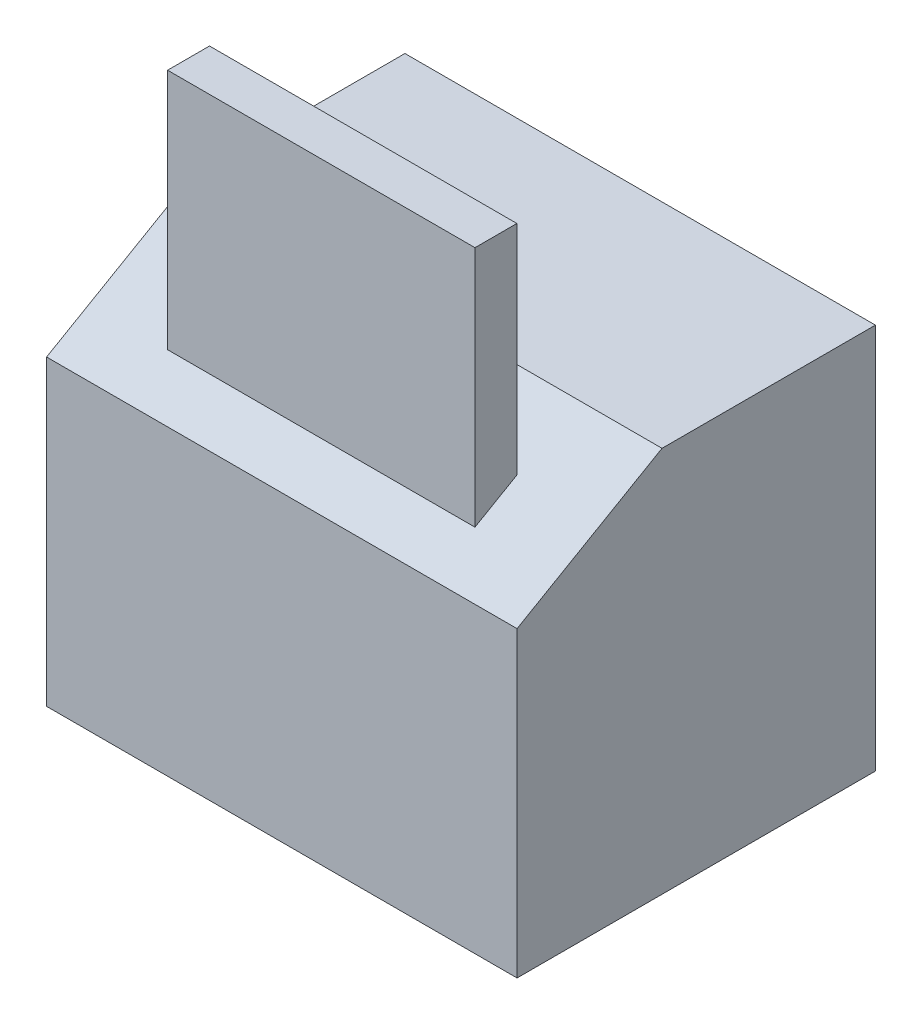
SolidWorks part; units mm, degrees
ref_plane "Front Plane" through (0, 0, 0) normal (0, 0, 1) x (1, 0, 0)
ref_plane "Top Plane" through (0, 0, 0) normal (0, 1, 0) x (1, 0, 0)
ref_plane "Right Plane" through (0, 0, 0) normal (1, 0, 0) x (0, 0, -1)
sketch "Sketch1" plane through (0, 0, 0) normal (0, 1, 0) x (1, 0, 0)
  line L1 (-45.9255, 34.384) -> (46.8873, 34.384)
  line L2 (-45.9255, 34.384) -> (-45.9255, -36.3076)
  line L3 (-45.9255, -36.3076) -> (46.8873, -36.3076)
  line L4 (46.8873, 34.384) -> (46.8873, -36.3076)
extrude "Extrude1" add sketch "Sketch1" along normal blind 76.2
sketch "Sketch2" plane through (0, 76.2, 0) normal (0, 1, 0) x (-1, 0, 0)
  line L1 (-30.2272, 27.9516) -> (30.4139, 27.9516)
  line L2 (-30.2272, 27.9516) -> (-30.2272, 19.6824)
  line L3 (-30.2272, 19.6824) -> (30.4139, 19.6824)
  line L4 (30.4139, 27.9516) -> (30.4139, 19.6824)
extrude "Extrude2" add sketch "Sketch2" along normal blind 36.068
chamfer "Chamfer2" distance 16.51 angle 60 1 edges at (0.4809, 76.2, 36.3076)
